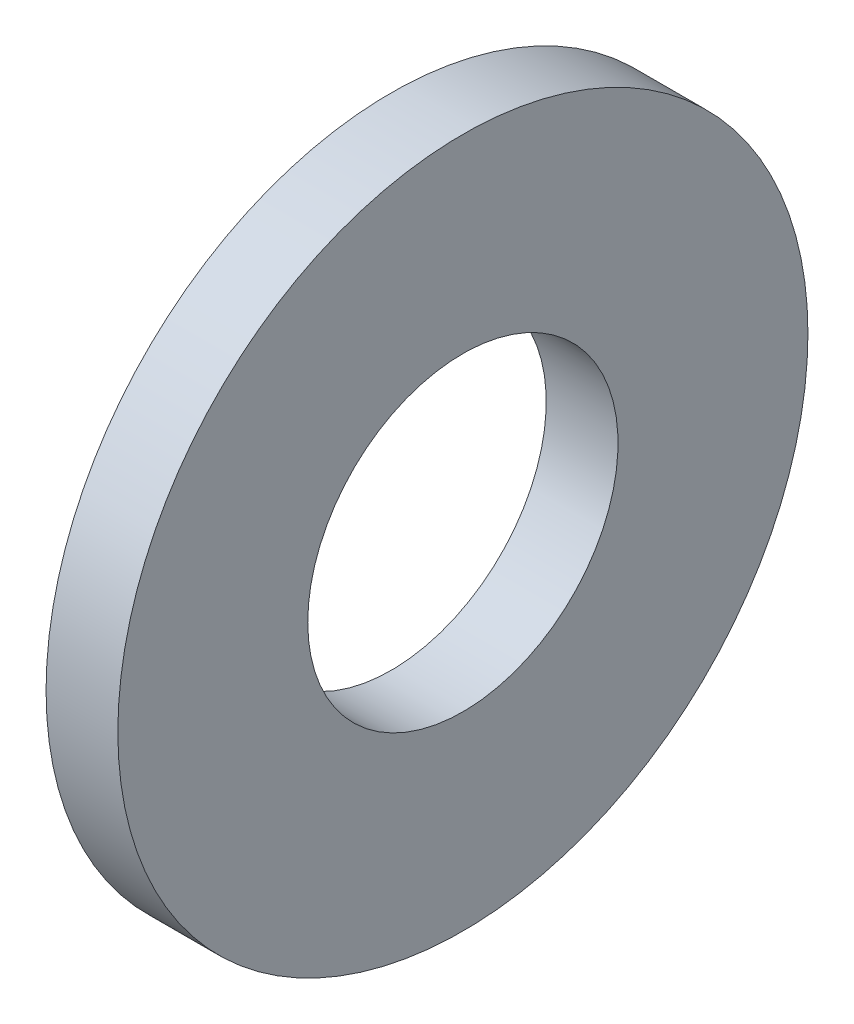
SolidWorks part; units mm, degrees
ref_plane "Plane1" through (0, 0, 0) normal (0, 0, 1) x (1, 0, 0)
ref_plane "Plane2" through (0, 0, 0) normal (0, 1, 0) x (1, 0, 0)
ref_plane "Plane3" through (0, 0, 0) normal (1, 0, 0) x (0, 0, -1)
revolve "Base-Revolve" add sketch "Sketch1" angle 360 about L0
sketch "Sketch1" plane through (0, 0, 0) normal (0, 0, 1) x (1, 0, 0)
  line L0 (-34.925, 0) -> (9.525, 0) construction
  line L1 (0, 3.5687) -> (0, 7.9375)
  line L2 (0, 7.9375) -> (-1.651, 7.9375)
  line L3 (-1.651, 7.9375) -> (-1.651, 3.5687)
  line L4 (-1.651, 3.5687) -> (0, 3.5687)
  dimension "Thickness" = 1.651
  dimension "Inside_dia" = 7.1374
  dimension "Outside_dia" = 15.875
